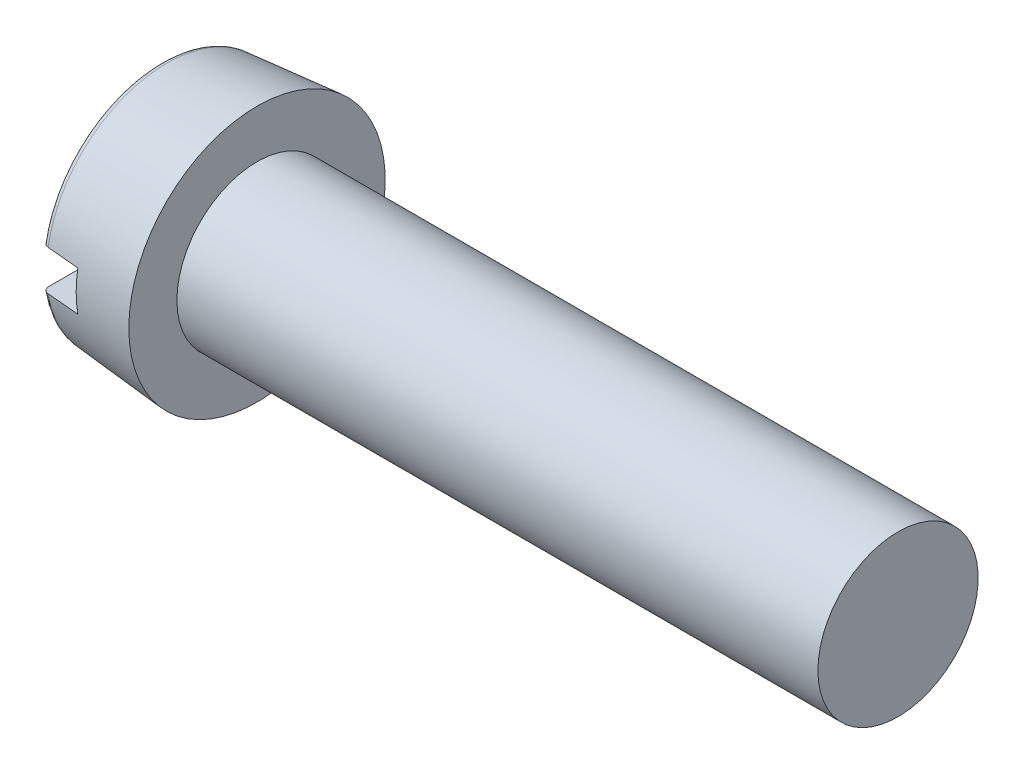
SolidWorks part; units mm, degrees
ref_plane "Plane1" through (0, 0, 0) normal (0, 0, 1) x (1, 0, 0)
ref_plane "Plane2" through (0, 0, 0) normal (0, 1, 0) x (1, 0, 0)
ref_plane "Plane3" through (0, 0, 0) normal (1, 0, 0) x (0, 0, -1)
other "Configuration Table"
sketch "BodySke" plane through (0, 0, 0) normal (0, 0, 1) x (1, 0, 0)
  line L0 (6, 5) -> (6, 8)
  line L1 (0, 0) -> (0, 7.4751)
  line L2 (-25.4, 0) -> (127, 0) construction
  line L3 (46, 0) -> (0, 0)
  line L4 (6, 5) -> (46, 5)
  line L5 (46, 5) -> (46, 0)
  line L6 (0, 7.4751) -> (6, 8)
  line L9 (7.5, 6.5875) -> (7.5, -2.9375) construction
  line L10 (6, 6.35) -> (6, -3.175) construction
revolve "Base-Revolve" add sketch "BodySke"
fillet "Fillet1" [suppressed] radius 0.4
fillet "Fillet2" radius 0.4 1 edges at (0, 0, 7.4751)
sketch "Sketch2" plane through (0, 0, 0) normal (1, 0, 0) x (0, 0, -1)
  line L0 (8, -1.25) -> (-8, -1.25)
  line L1 (8, -1.25) -> (8, 1.25)
  line L2 (-8, 1.25) -> (8, 1.25)
  line L3 (-8, 1.25) -> (-8, -1.25)
extrude "Slot" cut sketch "Sketch2" along normal blind 2.4
sketch "ThdSchSke" plane through (0, 0, 0) normal (0, 0, 1) x (1, 0, 0)
  line L0 (9, -4.1885) -> (8.4318, -5)
  line L1 (9, -4.1885) -> (9.5682, -5)
  line L2 (9.5682, -5) -> (9.5682, -6.25)
  line L3 (-3.175, 0) -> (5.1513, 0) construction
  line L5 (9.5682, -6.25) -> (8.4318, -6.25)
  line L6 (8.4318, -6.25) -> (8.4318, -5)
revolve "ThreadSchematic" [suppressed] cut sketch "ThdSchSke" angle 360 about L3
pattern_linear "ThdSchPat" [suppressed]
equation "\"D1@Sketch2\" = \"Head_dia@BodySke\""
equation "\"D2@Sketch2\" = \"D1@Sketch2\" / 2"
equation "\"D3@Sketch2\" = \"Slot_width@Sketch2\" / 2"
equation "\"Thread_length@ThreadCosmetic\" = ((sgn( (\"Length@BodySke\" - \"Advance@BodySke\" * 2.0 ) - \"Thread_nom@BodySke\" )-1)*( (\"Length@BodySke\" - \"Advance@BodySke\"  * 2.0) - \"Thread_nom@BodySke\" ))/-2+ \"Thread_"
equation "\"Thread_minor@ThdSchSke\" = \"Thread_minor@ThreadCosmetic\""
equation "\"Diameter@ThdSchSke\" = \"Diameter@BodySke\""
equation "\"Overcut@ThdSchSke\" = \"Diameter@BodySke\" * 1.25"
equation "\"Start@ThdSchSke\" = \"Head_ht@BodySke\" + \"Length@BodySke\" - \"Thread_length@ThreadCosmetic\"  '---Non-countersunk---"
equation "\"Num_threads@ThdSchPat\" = int( \"Thread_length@ThreadCosmetic\" / \"Advance@BodySke\" + 0.999 )  + 1"
equation "\"Advance@ThdSchPat\" = \"Thread_length@ThreadCosmetic\" /  (\"Num_threads@ThdSchPat\" - 1) 'relax it"
